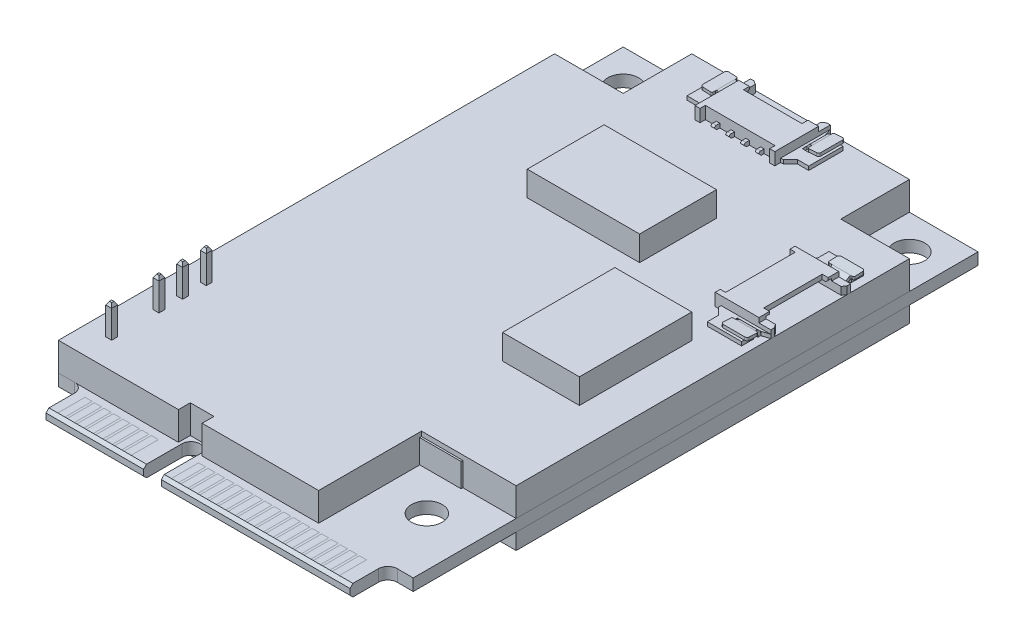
SolidWorks part; units mm, degrees
other "<c-1734261-4-a>-<Imported1>"
other "<c-1734261-4-a>-<Imported1>"
other "<4-pin-header>-<m22-2010546_01-1-solid1>"
other "<4-pin-header>-<Cut-Extrude1[1]>"
other "<4-pin-header>-<Cut-Extrude1[2]>"
other "<4-pin-header>-<Cut-Extrude1[3]>"
other "<4-pin-header>-<Cut-Extrude1[4]>"
ref_plane "Front Plane" through (0, 0, 0) normal (0, 0, 1) x (1, 0, 0)
ref_plane "Top Plane" through (0, 0, 0) normal (0, 1, 0) x (1, 0, 0)
ref_plane "Right Plane" through (0, 0, 0) normal (1, 0, 0) x (0, 0, -1)
imported_body "Imported1"
imported_body "Imported2"
imported_body "Imported3"
sketch "Sketch1" plane through (0, -1.35, 0) normal (0, -1, 0) x (1, 0, 0)
  line L0 (15, 20.375) -> (15, -19.675) construction
  line L2 (7, 20.375) -> (15, 20.375)
  line L3 (7, 20.375) -> (7, 13.575)
  line L4 (7, 13.575) -> (15, 13.575)
  line L5 (15, 20.375) -> (15, 13.575)
  line L6 (-3.1, 25.475) -> (12.85, 25.475) construction
  line L7 (-15, 20.375) -> (15, 20.375) construction
  point P8 (7, 16.975)
  dimension "D1" = 8.5
  dimension "D2" = 8
extrude "Cut-Extrude1" cut sketch "Sketch1" against normal up to surface (1.35 mm away)
sketch "Sketch3" plane through (0, 3.4, 0) normal (0, 1, 0) x (1, 0, 0)
  line L0 (7, -13.575) -> (15, -13.575) construction
  line L1 (15, -22.275) -> (7, -22.275)
  line L2 (15, -22.275) -> (15, -13.575)
  line L3 (15, -13.575) -> (7, -13.575)
  line L4 (7, -22.275) -> (7, -13.575)
extrude "Cut-Extrude3" cut sketch "Sketch3" against normal up to surface (2.4 mm away)
sketch "Sketch4" plane through (0, 1, 0) normal (0, 1, 0) x (1, 0, 0)
  line L0 (-15, -22.275) -> (-15, 19.675) construction
  line L1 (-3.1, -25.475) -> (12.85, -25.475) construction
  circle A0 centre (10.85, -16.975) radius 1.3
  circle A1 centre (12.1, 22.575) radius 1.3 construction
  circle A2 centre (12.1, 22.575) radius 1.3 construction
  dimension "D1" = 25.85
  dimension "D2" = 8.5
extrude "Cut-Extrude4" cut sketch "Sketch4" against normal up to next
sketch "Sketch6" plane through (0, 1, 0) normal (0, 1, 0) x (1, 0, 0)
  line L0 (15, 25.475) -> (-15, 25.475) construction
  line L1 (-5.6115, 14.475) -> (3.8885, 14.475)
  line L2 (-5.6115, 14.475) -> (-5.6115, 7.975)
  line L3 (-5.6115, 7.975) -> (3.8885, 7.975)
  line L4 (3.8885, 14.475) -> (3.8885, 7.975)
  line L5 (5.3, 4.475) -> (11.8, 4.475)
  line L6 (5.3, 4.475) -> (5.3, -5.025)
  line L7 (5.3, -5.025) -> (11.8, -5.025)
  line L8 (11.8, 4.475) -> (11.8, -5.025)
  line L9 (15, -22.275) -> (15, 25.475) construction
  dimension "D1" = 9.5
  dimension "D2" = 6.5
  dimension "D3" = 11
  dimension "D4" = 21
  dimension "D5" = 11.1115
  dimension "D6" = 3.2
extrude "Boss-Extrude1" add sketch "Sketch6" along normal blind 4.5
sketch "Sketch7" plane through (0, 1, 0) normal (0, 1, 0) x (1, 0, 0)
  line L0 (-15, 25.475) -> (-15, -22.275) construction
  line L1 (-14.35, 13.675) -> (-6.85, 13.675)
  line L2 (-14.35, 13.675) -> (-14.35, 8.675)
  line L3 (-14.35, 8.675) -> (-6.85, 8.675)
  line L4 (-6.85, 13.675) -> (-6.85, 8.675)
  line L5 (-11.8, 1.275) -> (-1.8, 1.275)
  line L6 (-11.8, 1.275) -> (-11.8, -8.725)
  line L7 (-11.8, -8.725) -> (-1.8, -8.725)
  line L8 (-1.8, 1.275) -> (-1.8, -8.725)
  line L9 (5.5, -6.225) -> (10.5, -6.225)
  line L10 (5.5, -6.225) -> (5.5, -13.725)
  line L11 (5.5, -13.725) -> (10.5, -13.725)
  line L12 (10.5, -6.225) -> (10.5, -13.725)
  line L13 (15, 25.475) -> (-15, 25.475) construction
  line L14 (15, -22.275) -> (15, 25.475) construction
  dimension "D1" = 7.5
  dimension "D2" = 0.65
  dimension "D3" = 5
  dimension "D4" = 11.8
  dimension "D5" = 3.2
  dimension "D6" = 24.2
  dimension "D7" = 31.7
  dimension "D8" = 10
  dimension "D9" = 4.5
extrude "Boss-Extrude2" add sketch "Sketch7" along normal blind 2
sketch "Sketch5" plane through (0, 3.4, 0) normal (0, 1, 0) x (1, 0, 0)
  line L0 (62, 297) -> (310, 297) construction
ref_plane "Front Plane-4-pin-header" through (-13, 2.5, 9.775) normal (-1, 0, 0) x (0, 0, 1)
ref_plane "Top Plane-4-pin-header" through (-13, 2.5, 9.775) normal (0, 1, 0) x (0, 0, 1)
ref_plane "Right Plane-4-pin-header" through (-13, 2.5, 9.775) normal (0, 0, 1) x (1, 0, 0)
sketch "Sketch1-4-pin-header" plane through (-14, 2.5, 9.775) normal (-1, 0, 0) x (0, 0, 1)
  line L1 (1.75, -3.5) -> (10.25, -3.5)
  line L2 (1.75, -3.5) -> (1.75, -4.9)
  line L3 (1.75, -4.9) -> (10.25, -4.9)
  line L4 (10.25, -3.5) -> (10.25, -4.9)
inserted part "4-pin-header"
move or copy body "Body-Move/Copy4" placed by mates yes parameters "D1"=0, "D2"=0, "D3"=0
other "Distance3" parameters "D1"=1.5
other "Distance4" parameters "D1"=1
ref_plane "Front Plane-c-1734261-4-a" through (15, 3.1, -11.33) normal (1, 0, 0) x (0, 0, -1)
ref_plane "Top Plane-c-1734261-4-a" through (15, 3.1, -11.33) normal (0, 1, 0) x (0, 0, -1)
ref_plane "Right Plane-c-1734261-4-a" through (15, 3.1, -11.33) normal (0, 0, -1) x (-1, 0, 0)
inserted part "c-1734261-4-a" parameters "D1"=0, "D2"=0, "D3"=0
move or copy body "Body-Move/Copy6"
other "Distance9" parameters "D1"=0
other "Distance10" parameters "D1"=9
ref_plane "Front Plane-c-1734261-4-a2" through (-0.855, 3.1, -25.475) normal (0, 0, -1) x (-1, 0, 0)
ref_plane "Top Plane-c-1734261-4-a2" through (-0.855, 3.1, -25.475) normal (0, 1, 0) x (-1, 0, 0)
ref_plane "Right Plane-c-1734261-4-a2" through (-0.855, 3.1, -25.475) normal (-1, 0, 0) x (0, 0, 1)
inserted part "c-1734261-4-a2" parameters "D1"=0, "D2"=0, "D3"=0
move or copy body "Body-Move/Copy8"
other "Distance11" parameters "D1"=9
